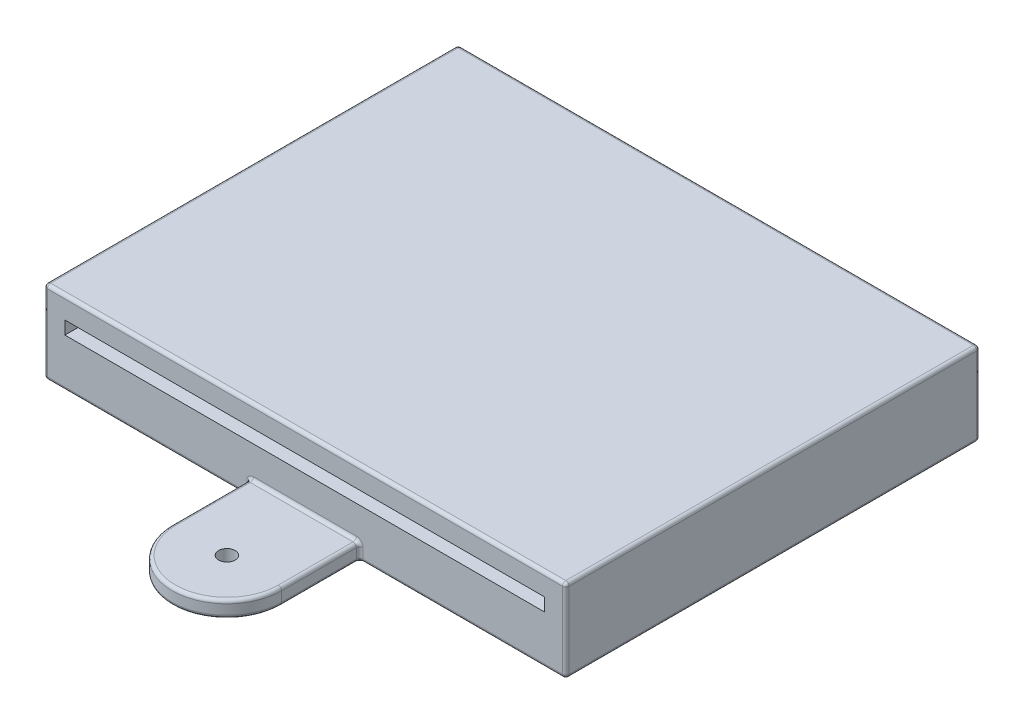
SolidWorks part; units mm, degrees
ref_plane "Front Plane" through (0, 0, 0) normal (0, 0, 1) x (1, 0, 0)
ref_plane "Top Plane" through (0, 0, 0) normal (0, 1, 0) x (1, 0, 0)
ref_plane "Right Plane" through (0, 0, 0) normal (1, 0, 0) x (0, 0, -1)
sketch "Sketch1" plane through (0, 0, 0) normal (0, 1, 0) x (1, 0, 0)
  line L0 (-400, -317.5) -> (400, 317.5) construction
  line L1 (-400, -317.5) -> (400, -317.5)
  line L2 (-400, -317.5) -> (-400, 317.5)
  line L3 (-400, 317.5) -> (400, 317.5)
  line L4 (400, -317.5) -> (400, 317.5)
  dimension "D1" = 800
  dimension "D2" = 635
extrude "Extrude1" add sketch "Sketch1" along normal blind 127
sketch "Sketch2" plane through (0, 0, 0) normal (0, -1, 0) x (1, 0, 0)
  line L0 (-83.9969, 317.5) -> (-83.9969, 437.134)
  line L1 (-400, 317.5) -> (400, 317.5) construction
  line L2 (83.9969, 437.134) -> (83.9969, 317.5)
  line L3 (-83.9969, 317.5) -> (83.9969, 317.5)
  line L4 (0, 437.134) -> (0, 0) construction
  arc A0 (-83.9969, 437.134) -> (83.9969, 437.134) centre (0, 437.134) cw
  dimension "D1" = 119.634
extrude "Extrude2" add sketch "Sketch2" against normal blind 25.4
sketch "Sketch3" plane through (0, 0, 0) normal (0, -1, 0) x (1, 0, 0)
  circle A0 centre (0, 437.134) radius 12.7
  circle A1 centre (0, 437.134) radius 12.7 construction
extrude "Cut-Extrude1" cut sketch "Sketch3" against normal through all
sketch "Sketch4" plane through (0, 0, 317.5) normal (0, 0, 1) x (1, 0, 0)
  line L0 (-400, 127) -> (-400, 0) construction
  line L1 (-368, 94) -> (367, 94)
  line L2 (-368, 94) -> (-368, 74)
  line L3 (-368, 74) -> (367, 74)
  line L4 (367, 94) -> (367, 74)
  line L5 (400, 127) -> (400, 0) construction
  line L6 (-400, 127) -> (400, 127) construction
  dimension "D1" = 32
  dimension "D2" = 33
  dimension "D3" = 20
  dimension "D4" = 33
extrude "Cut-Extrude2" cut sketch "Sketch4" against normal blind 76.2
fillet "Fillet1" radius 5.08 23 edges at (0, 25.4, 317.5) (83.9969, 25.4, 377.317) (-83.9969, 25.4, 377.317) (0, 127, 317.5) (0, 127, -317.5) (400, 63.5, 317.5) (400, 127, 0) (400, 63.5, -317.5) (-400, 63.5, -317.5) (-400, 127, 0) (-400, 63.5, 317.5) (0, 0, 521.1309) (0, 25.4, 521.1309) (400, 0, 0) (0, 0, -317.5) (-400, 0, 0) (0, 0, 424.434)
